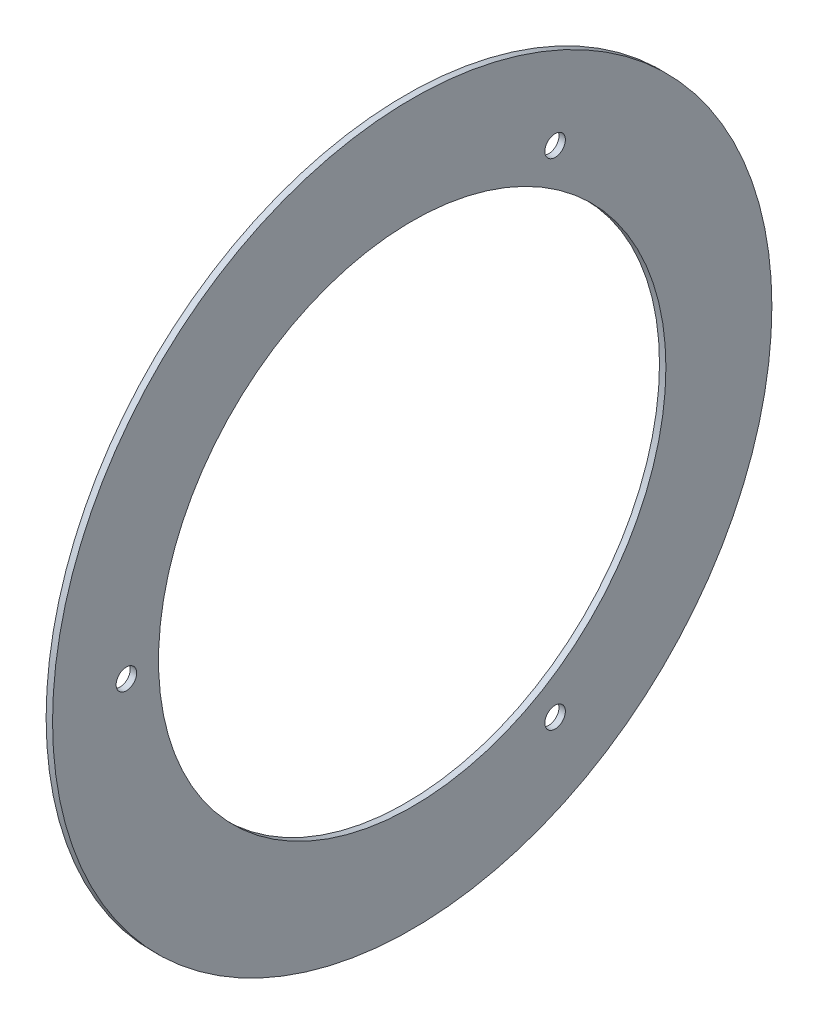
SolidWorks part; units mm, degrees
ref_plane "Vorne" through (0, 0, 0) normal (0, 0, 1) x (1, 0, 0)
ref_plane "Oben" through (0, 0, 0) normal (0, 1, 0) x (1, 0, 0)
ref_plane "Rechts" through (0, 0, 0) normal (1, 0, 0) x (0, 0, -1)
sketch "Skizze1" plane through (0, 0, 0) normal (1, 0, 0) x (0, 0, -1)
  circle A0 centre (0, 0) radius 39.5
  circle A1 centre (0, 0) radius 56
  dimension "D1" = 112
  dimension "D2" = 79
extrude "Linear austragen1" add sketch "Skizze1" along normal blind 1
hole_wizard "Ø3.2 (3.2) Durchmesser Bohrung1" positions "Skizze3" profile "Skizze2" hole size "Ø3.2" standard "ISO"
sketch "Skizze3" plane through (1, 0, 0) normal (1, 0, 0) x (0, 0, -1)
  point P0 (22.25, 38.5381)
  point P1 (-44.5, 0)
  point P3 (22.25, -38.5381)
sketch "Skizze2" plane through (1, 38.5381, -22.25) normal (0, 1, 0) x (0, 0, -1)
  line L0 (0, 0) -> (0, 1)
  line L1 (0, 1) -> (1.6, 1)
  line L2 (1.6, 1) -> (1.6, 0)
  line L5 (1.6, 0) -> (0, 0)
  line L11 (0, -6.35) -> (0, 107.95) construction
  dimension "Bohrerdurchmesser" = 3.2
  dimension "Bohrungstiefe" = 1
